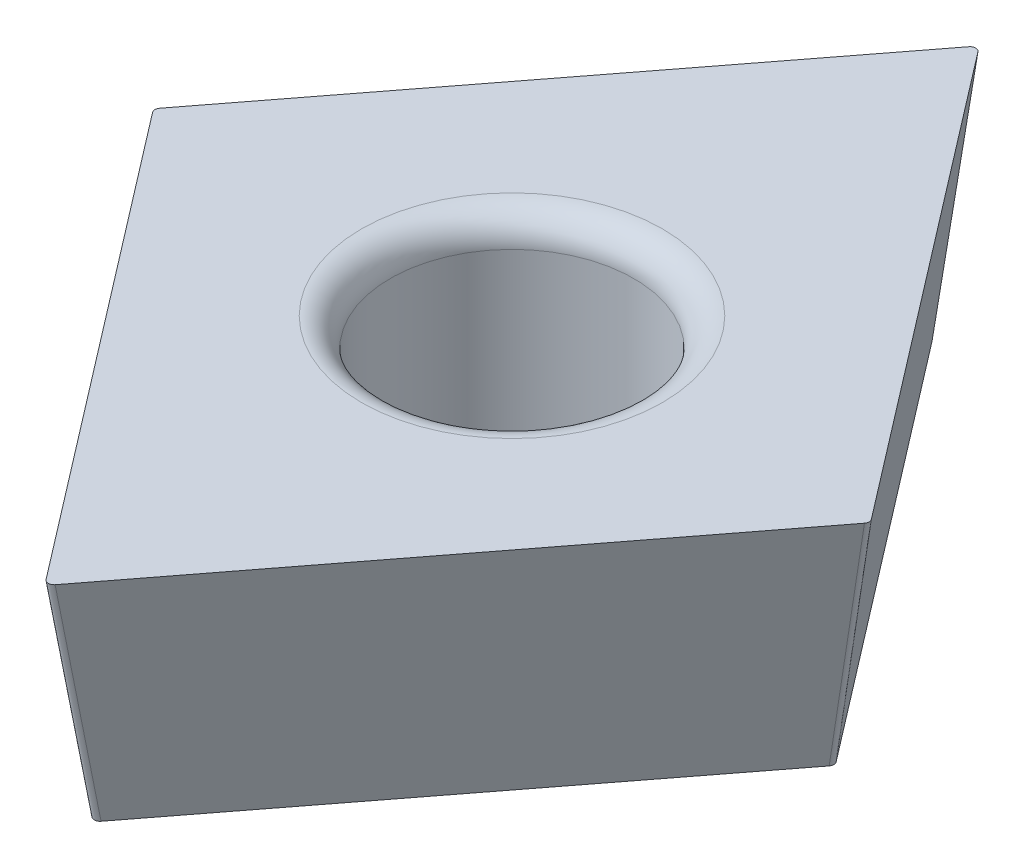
SolidWorks part; units mm, degrees
ref_plane "Front Plane" through (0, 0, 0) normal (0, 0, 1) x (1, 0, 0)
ref_plane "Top Plane" through (0, 0, 0) normal (0, 1, 0) x (1, 0, 0)
ref_plane "Right Plane" through (0, 0, 0) normal (1, 0, 0) x (0, 0, -1)
ref_plane "Plane1" through (0, 1.59, 0) normal (0, 1, 0) x (1, 0, 0)
sketch "Sketch1" plane through (0, 1.59, 0) normal (0, 1, 0) x (1, 0, 0)
  line L0 (0, 6.5214) -> (0, -6.5214) construction
  line L1 (5.0041, 0) -> (0, 6.5214)
  line L2 (0, 6.5214) -> (-5.0041, 0)
  line L3 (-5.0041, 0) -> (0, -6.5214)
  line L4 (0, -6.5214) -> (5.0041, 0)
  circle A0 centre (0, 0) radius 3.97 construction
  dimension "D3" = 7.94
  dimension "D1" = 75
  dimension "D2" = 75
extrude "Boss-Extrude1" add sketch "Sketch1" against normal blind 3.18 draft 7
fillet "Fillet1" radius 0.08 4 edges at (4.758, 0, 0) (0, 0, -6.2007) (-4.758, 0, 0) (0, 0, 6.2007)
sketch "Sketch5" plane through (0, 1.59, 0) normal (0, 1, 0) x (1, 0, 0)
  circle A0 centre (0, 0) radius 1.7
  dimension "D1" = 3.4
extrude "Cut-Extrude1" cut sketch "Sketch5" against normal up to next
fillet "Fillet2" radius 0.4 1 edges at (0, 1.59, 1.7)
